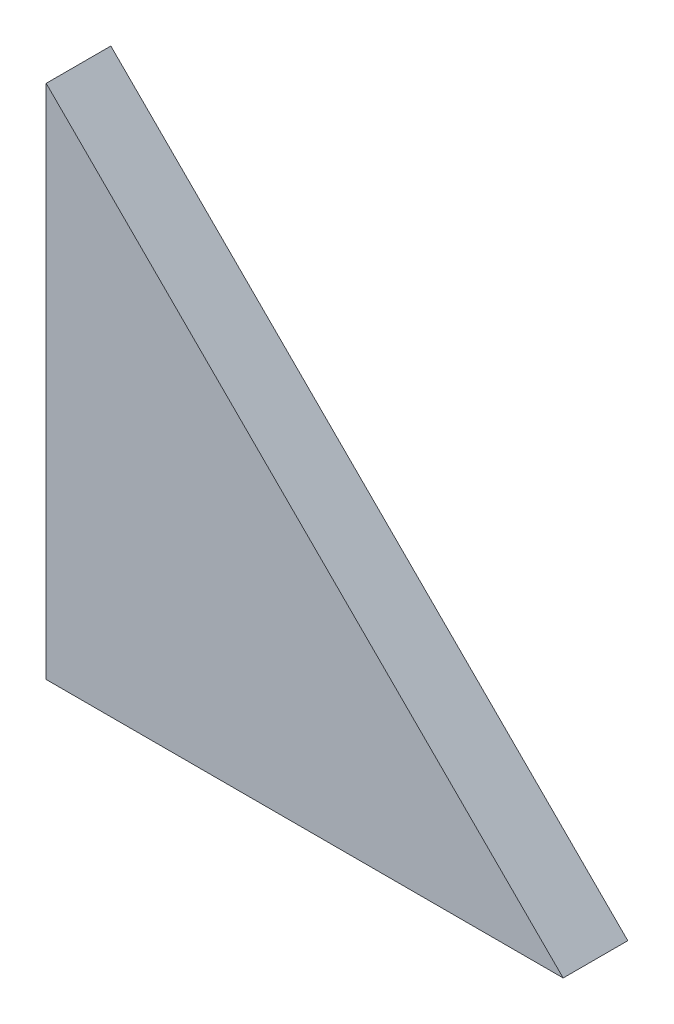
SolidWorks part; units mm, degrees
ref_plane "Front Plane" through (0, 0, 0) normal (0, 0, 1) x (1, 0, 0)
ref_plane "Top Plane" through (0, 0, 0) normal (0, 1, 0) x (1, 0, 0)
ref_plane "Right Plane" through (0, 0, 0) normal (1, 0, 0) x (0, 0, -1)
sketch "Sketch1" plane through (0, 0, 0) normal (0, 0, 1) x (1, 0, 0)
  line L0 (0, 0) -> (0, 101.4762)
  line L1 (0, 101.4762) -> (101.6, 0)
  line L2 (101.6, 0) -> (0, 0)
  dimension "D1" = 101.6
  dimension "D2" = 101.4762
extrude "Extrude1" add sketch "Sketch1" along normal blind 12.7
